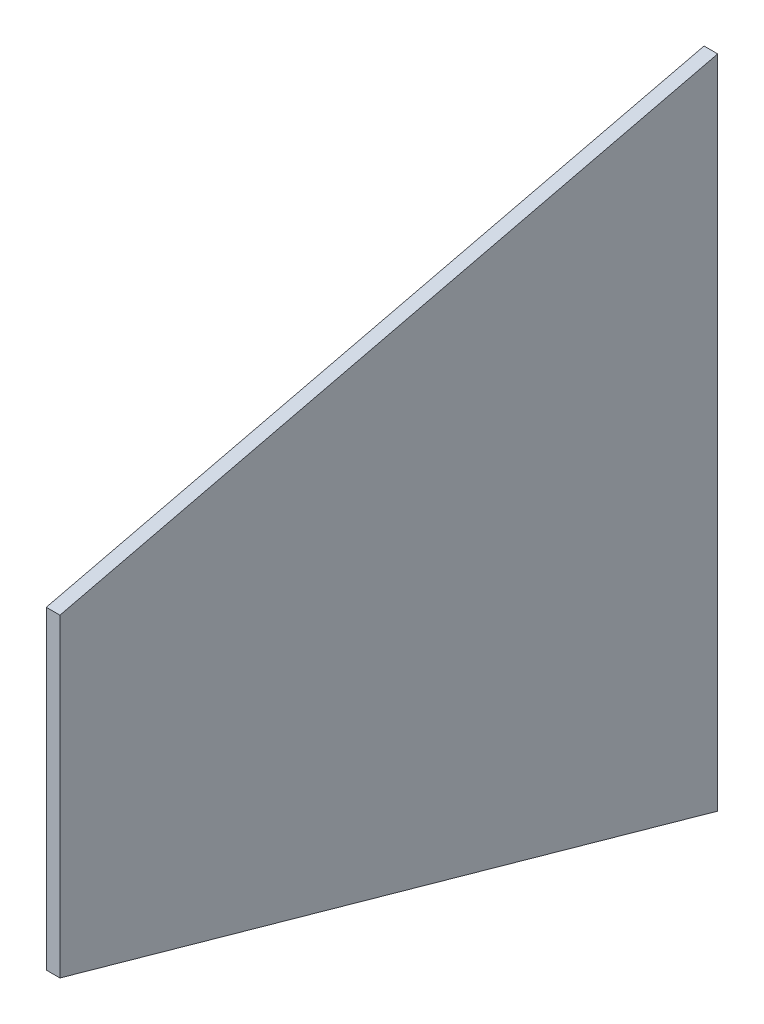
SolidWorks part; units mm, degrees
ref_plane "Front Plane" through (0, 0, 0) normal (1, 0, 0) x (0, 1, 0)
ref_plane "Top Plane" through (0, 0, 0) normal (0, 0, 1) x (0, 1, 0)
ref_plane "Right Plane" through (0, 0, 0) normal (0, 1, 0) x (-1, 0, 0)
sketch "Sketch1" plane through (0, 0, 0) normal (1, 0, 0) x (0, 1, 0)
  line L0 (0, 0) -> (304.8, 0)
  line L1 (304.8, 0) -> (231.7432, 305.7171)
  line L2 (231.7432, 305.7171) -> (85.6932, 305.7171)
  line L3 (85.6932, 305.7171) -> (0, 0)
extrude "Measured_asymmetric_panel" add sketch "Sketch1" along normal blind 6.35
